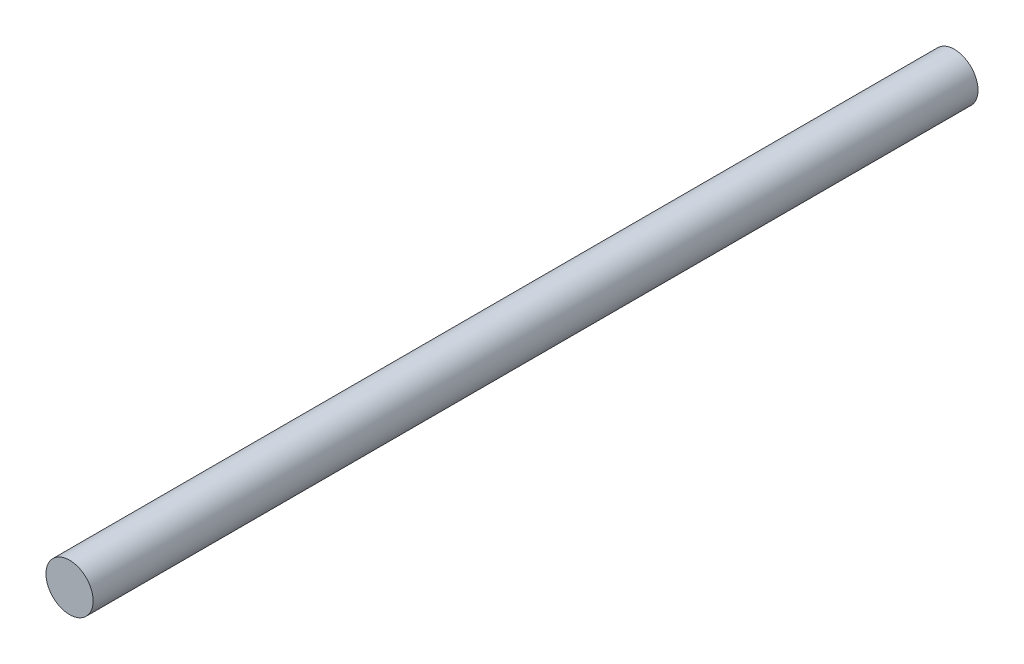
SolidWorks part; units mm, degrees
ref_plane "Face" through (0, 0, 0) normal (0, 0, 1) x (1, 0, 0)
ref_plane "Dessus" through (0, 0, 0) normal (0, 1, 0) x (1, 0, 0)
ref_plane "Droite" through (0, 0, 0) normal (1, 0, 0) x (0, 0, -1)
sketch "Esquisse1" plane through (0, 0, 0) normal (0, 0, 1) x (1, 0, 0)
  circle A0 centre (0, 0) radius 4
  dimension "D1" = 8
extrude "Base-Extrusion" add sketch "Esquisse1" along normal blind 150
